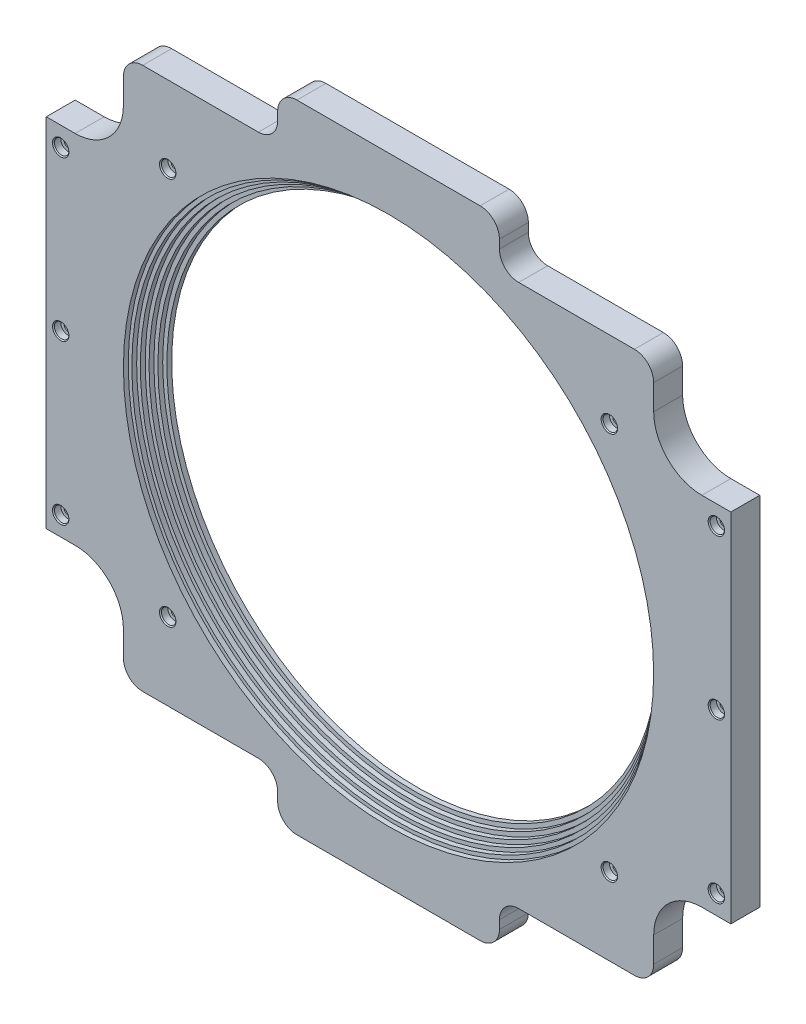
SolidWorks part; units mm, degrees
ref_plane "Front Plane" through (0, 0, 0) normal (0, 0, 1) x (1, 0, 0)
ref_plane "Top Plane" through (0, 0, 0) normal (0, 1, 0) x (1, 0, 0)
ref_plane "Right Plane" through (0, 0, 0) normal (1, 0, 0) x (0, 0, -1)
sketch "Sketch1" plane through (0, 0, 0) normal (0, 0, 1) x (1, 0, 0)
  line L1 (225.425, -209.55) -> (225.425, 209.55)
  line L2 (-225.425, -209.55) -> (-225.425, 209.55)
  line L3 (0, 249.5064) -> (0, -235.6951) construction
  line L4 (225.425, -209.55) -> (-225.425, -209.55)
  line L13 (225.425, 209.55) -> (-225.425, 209.55)
  line L87 (-338.7122, 0) -> (338.7122, 0) construction
  dimension "D2" = 419.1
  dimension "D1" = 450.85
extrude "Extrude1" add sketch "Sketch1" along normal blind 19.05
sketch "Sketch4" plane through (0, 0, 0) normal (0, 1, 0) x (-1, 0, 0)
  line L0 (0, 479.1694) -> (0, -459.1612) construction
  line L2 (-215.9, 146.05) -> (0, 146.05)
  line L3 (0, 146.05) -> (0, -69.85)
  line L8 (-225.425, 0) -> (225.425, 0) construction
  line L9 (-225.425, 19.05) -> (225.425, 19.05) construction
  line L10 (-225.425, 19.05) -> (-225.425, 0) construction
  line L11 (225.425, 19.05) -> (225.425, 0) construction
  arc A3 (-215.9, 146.05) -> (0, -69.85) centre (0, 146.05) ccw
  dimension "D2" = 146.05
  dimension "D1" = 215.9
  dimension "D3" = 127
revolve "Cut-Revolve1" cut sketch "Sketch4" angle 360 about L0
sketch "Sketch13" plane through (0, 0, 0) normal (0, 1, 0) x (1, 0, 0)
  line L0 (0, 117.149) -> (0, -88.8703) construction
  line L1 (-225.425, 0) -> (-174.625, 0)
  line L2 (-225.425, 0) -> (-225.425, 12.7)
  line L3 (-225.425, 12.7) -> (-174.625, 12.7)
  line L4 (-174.625, 0) -> (-174.625, 12.7)
  line L5 (174.625, 0) -> (174.625, 12.7)
  line L6 (225.425, 12.7) -> (174.625, 12.7)
  line L7 (225.425, 0) -> (225.425, 12.7)
  line L8 (225.425, 0) -> (174.625, 0)
  line L9 (225.425, 0) -> (-225.425, 0) construction
  arc A0 (174.5961, -19.05) -> (159.0038, 0) centre (0, -146.05) ccw construction
  dimension "D2" = 158.75
  dimension "D1" = 50.8
extrude "Boss-Extrude1" [suppressed] add sketch "Sketch13" along normal mid plane 254
sketch "Sketch6" plane through (0, 0, 19.05) normal (0, 0, 1) x (1, 0, 0)
  line L0 (-174.625, 209.55) -> (-174.625, 149.225)
  line L1 (40.5951, 0) -> (552.197, 0) construction
  line L2 (225.425, 209.55) -> (-225.425, 209.55) construction
  line L3 (225.425, 209.55) -> (-225.425, 209.55) construction
  line L4 (-206.375, 117.475) -> (-225.425, 117.475)
  line L5 (225.425, 209.55) -> (225.425, 117.475)
  line L6 (0, 261.7294) -> (0, -209.7416) construction
  line L7 (-225.425, -209.55) -> (225.425, -209.55) construction
  line L8 (174.625, -209.55) -> (174.625, -149.225)
  line L9 (-174.625, 209.55) -> (-225.425, 209.55)
  line L10 (-225.425, 209.55) -> (-225.425, 117.475)
  line L11 (206.375, -117.475) -> (225.425, -117.475)
  line L12 (174.625, -209.55) -> (225.425, -209.55)
  line L13 (-225.425, 209.55) -> (-225.425, -209.55) construction
  line L14 (174.625, 209.55) -> (225.425, 209.55)
  line L15 (-225.425, -209.55) -> (-225.425, -117.475)
  line L16 (-174.625, -209.55) -> (-225.425, -209.55)
  line L17 (206.375, 117.475) -> (225.425, 117.475)
  line L18 (174.625, 209.55) -> (174.625, 149.225)
  line L19 (225.425, -209.55) -> (225.425, 209.55) construction
  line L20 (225.425, -209.55) -> (225.425, -117.475)
  line L21 (-206.375, -117.475) -> (-225.425, -117.475)
  line L22 (-174.625, -209.55) -> (-174.625, -149.225)
  line L25 (-225.425, 209.55) -> (-225.425, -209.55) construction
  arc A0 (-174.625, 149.225) -> (-206.375, 117.475) centre (-206.375, 149.225) cw
  arc A1 (174.625, -149.225) -> (206.375, -117.475) centre (206.375, -149.225) cw
  arc A2 (-174.625, -149.225) -> (-206.375, -117.475) centre (-206.375, -149.225) ccw
  arc A3 (174.625, 149.225) -> (206.375, 117.475) centre (206.375, 149.225) ccw
  dimension "D1" = 31.75
  dimension "D2" = 50.8
  dimension "D3" = 117.475
extrude "Cut-Extrude2" cut sketch "Sketch6" against normal through all
hole_wizard "CSK for #10 Flat Head Machine Screw1" positions "Sketch3" profile "Sketch2" counterbore size "#10" standard "ANSI Inch"
sketch "Sketch3" plane through (-1041.591, 12.6399, 19.05) normal (0, 0, 1) x (1, 0, 0)
  line L8 (1013.3222, -12.6399) -> (1626.7288, -12.6399) construction
  line L9 (1041.591, 292.7275) -> (1041.591, -277.4126) construction
  line L15 (816.166, 104.8351) -> (816.166, -130.1149) construction
  line L16 (1267.016, -130.1149) -> (1267.016, 104.8351) construction
  line L17 (1216.216, 196.9101) -> (866.966, 196.9101) construction
  line L18 (866.966, -222.1899) -> (1216.216, -222.1899) construction
  point P56 (825.691, -117.4149)
  point P58 (825.691, 92.1351)
  point P71 (1257.491, 92.1351)
  point P72 (1257.491, -117.4149)
  point P73 (825.691, -12.6399)
  point P75 (1257.491, -12.6399)
  dimension "D1" = 104.775
  dimension "D2" = 9.525
  dimension "D3" = 209.55
  dimension "D4" = 209.55
  dimension "D5" = 104.775
sketch "Sketch2" plane through (-215.9, -104.775, 19.05) normal (1, 0, 0) x (0, -1, 0)
  line L0 (0, 0) -> (0, 19.05)
  line L1 (0, 19.05) -> (2.5527, 19.05)
  line L3 (2.5527, 19.05) -> (2.5527, 4.826)
  line L4 (4.7625, 4.826) -> (2.5527, 4.826)
  line L5 (4.7625, 4.826) -> (4.7625, 0.635)
  line L6 (4.7625, 0.635) -> (5.3975, 0)
  line L7 (5.3975, 0) -> (0, 0)
  line L8 (-4.7625, 0.635) -> (-5.3975, 0) construction
  line L11 (0, -6.35) -> (0, 107.95) construction
  dimension "Thru Hole Dia." = 5.1054
  dimension "Thru Hole Depth" = 19.05
  dimension "C'Bore Dia." = 9.525
  dimension "C'Bore Depth" = 4.826
  dimension "Near C'Sink Dia." = 10.795
  dimension "Near C'Sink Angle" = 90
ref_plane "Plane1" through (-206.375, 0, 0) normal (-1, 0, 0) x (0, 0, 1)
ref_plane "Plane2" through (206.375, 0, 0) normal (1, 0, 0) x (0, 0, -1)
sketch "Sketch9" [suppressed] plane through (0, 0, 19.05) normal (0, 0, 1) x (1, 0, 0)
  line L0 (-92.5491, 187.325) -> (-117.9491, 164.2896)
  line L1 (114.1476, 187.325) -> (-114.1476, 187.325) construction
  line L2 (-92.5491, 187.325) -> (-117.9491, 187.325)
  line L3 (-117.9491, 187.325) -> (-117.9491, 164.2896)
  line L4 (37.6647, 0) -> (541.2136, 0) construction
  line L5 (0, 239.5347) -> (0, -224.9036) construction
  line L6 (117.9491, 187.325) -> (117.9491, 164.2896)
  line L7 (92.5491, 187.325) -> (117.9491, 187.325)
  line L8 (92.5491, 187.325) -> (117.9491, 164.2896)
  arc A0 (-145.8976, 117.475) -> (-114.1476, 149.225) centre (-145.8976, 149.225) ccw construction
  circle A1 centre (0, 0) radius 146.3258 construction
  point P15 (0, 0)
  dimension "D1" = 25.4
extrude "Cut-Extrude3" [suppressed] cut sketch "Sketch9" against normal through all
fillet "Fillet1" [suppressed] radius 12.7
hole_wizard "CSK for #10 Flat Head Machine Screw3" positions "Sketch11" profile "Sketch10" countersink size "#10" standard "Ansi Inch"
sketch "Sketch11" plane through (0, 0, 5023.9787) normal (0, 0, 1) x (1, 0, 0)
  line L0 (28.4264, 0) -> (600.4187, 0) construction
  line L2 (298.9946, 243.5395) -> (298.9946, -263.2817) construction
  line L4 (73.5696, 117.475) -> (73.5696, -117.475) construction
  line L5 (524.4196, -117.475) -> (524.4196, 117.475) construction
  ellipse E0 centre (506.3852, 123.825) end of major axis (511.8382, 123.825) minor radius 4.7625 construction
  point P0 (500.9321, 123.825)
  point P10 (467.2696, 123.825)
  point P26 (130.7196, 123.825)
  point P27 (97.057, 123.825)
  point P28 (97.057, -123.825)
  point P29 (130.7196, -123.825)
  point P30 (467.2696, -123.825)
  point P31 (500.9321, -123.825)
sketch "Sketch10" plane through (500.9321, 123.825, 5023.9787) normal (1, 0, 0) x (0, -1, 0)
  line L0 (0, 0) -> (0, 19.05)
  line L1 (0, 19.05) -> (2.5527, 19.05)
  line L2 (2.5527, 19.05) -> (2.5527, 2.9422)
  line L3 (2.5527, 2.9422) -> (5.1103, 0)
  line L5 (5.1103, 0) -> (0, 0)
  line L6 (-2.5527, 2.9422) -> (-5.1103, 0) construction
  line L11 (0, -6.35) -> (0, 107.95) construction
  dimension "Thru Hole Dia." = 5.1054
  dimension "Thru Hole Depth" = 19.05
  dimension "Near C'Sink Dia." = 10.2206
  dimension "Near C'Sink Angle" = 82
sketch "Sketch12" [suppressed] plane through (0, 0, 19.05) normal (0, 0, 1) x (1, 0, 0)
  line L0 (-225.425, 117.475) -> (-145.8976, 117.475) construction
  line L1 (68.3138, 235.9936) -> (538.7035, 235.9936)
  line L2 (68.3138, 235.9936) -> (68.3138, 117.475)
  line L3 (68.3138, 117.475) -> (538.7035, 117.475)
  line L4 (538.7035, 235.9936) -> (538.7035, 117.475)
  line L5 (538.7035, -235.9936) -> (538.7035, -117.475)
  line L6 (0, 0) -> (609.9375, 0) construction
  line L7 (68.3138, -117.475) -> (538.7035, -117.475)
  line L8 (68.3138, -235.9936) -> (68.3138, -117.475)
  line L9 (68.3138, -235.9936) -> (538.7035, -235.9936)
extrude "Cut-Extrude4" [suppressed] cut sketch "Sketch12" against normal up to next
sketch "Sketch18" plane through (0, 0, 19.05) normal (0, 0, 1) x (1, 0, 0)
  line L0 (-161.925, 178.562) -> (161.925, 178.562) construction
  line L1 (-161.925, 178.562) -> (-85.725, 178.562)
  line L2 (-73.025, 191.262) -> (-73.025, 209.55)
  line L3 (174.625, 209.55) -> (-174.625, 209.55) construction
  line L4 (-73.025, 209.55) -> (-174.625, 209.55)
  line L5 (-174.625, 209.55) -> (-174.625, 165.862)
  line L6 (0, 0) -> (0, 341.8315) construction
  line L7 (-285.496, 0) -> (312.9281, 0) construction
  line L8 (174.625, 209.55) -> (174.625, 165.862)
  line L9 (73.025, 209.55) -> (174.625, 209.55)
  line L10 (73.025, 191.262) -> (73.025, 209.55)
  line L11 (161.925, 178.562) -> (85.725, 178.562)
  line L12 (161.925, -178.562) -> (85.725, -178.562)
  line L13 (73.025, -191.262) -> (73.025, -209.55)
  line L14 (73.025, -209.55) -> (174.625, -209.55)
  line L15 (174.625, -209.55) -> (174.625, -165.862)
  line L16 (-174.625, -209.55) -> (-174.625, -165.862)
  line L17 (-73.025, -209.55) -> (-174.625, -209.55)
  line L18 (-73.025, -191.262) -> (-73.025, -209.55)
  line L19 (-161.925, -178.562) -> (-85.725, -178.562)
  arc A0 (-161.925, 178.562) -> (-174.625, 165.862) centre (-161.925, 165.862) ccw construction
  arc A1 (-161.925, 178.562) -> (-174.625, 165.862) centre (-161.925, 165.862) ccw
  arc A2 (-73.025, 191.262) -> (-85.725, 178.562) centre (-85.725, 191.262) cw
  arc A3 (73.025, 191.262) -> (85.725, 178.562) centre (85.725, 191.262) ccw
  arc A4 (161.925, 178.562) -> (174.625, 165.862) centre (161.925, 165.862) cw
  arc A5 (161.925, -178.562) -> (174.625, -165.862) centre (161.925, -165.862) ccw
  arc A6 (73.025, -191.262) -> (85.725, -178.562) centre (85.725, -191.262) cw
  arc A7 (-73.025, -191.262) -> (-85.725, -178.562) centre (-85.725, -191.262) ccw
  arc A8 (-161.925, -178.562) -> (-174.625, -165.862) centre (-161.925, -165.862) cw
  dimension "D2" = 12.7
  dimension "D1" = 101.6
extrude "Cut-Extrude6" cut sketch "Sketch18" against normal through all
hole_wizard "CBORE for #10 Socket Head Cap Screw1" positions "Sketch15" profile "Sketch14" counterbore size "#10" standard "ANSI Inch"
sketch "Sketch15" plane through (0, 0, 19.05) normal (0, 0, 1) x (1, 0, 0)
  line L4 (-248.1702, -127.762) -> (254.3296, -127.762) construction
  line L6 (-74.516, -140.462) -> (74.516, -140.462) construction
  line L7 (109.7403, -115.062) -> (-109.7403, -115.062) construction
  line L8 (-174.625, -165.862) -> (-174.625, -149.225) construction
  line L9 (174.625, -149.225) -> (174.625, -165.862) construction
  line L10 (-290.8812, 0) -> (327.202, 0) construction
  line L11 (0, 298.3796) -> (0, -74.091) construction
  point P12 (-145.415, -127.762)
  point P14 (145.415, -127.762)
  point P25 (145.415, 127.762)
  point P26 (-145.415, 127.762)
  point P52 (0, 0)
  point P53 (0, 0)
  point P54 (0, 0)
  point P55 (0, 0)
  point P56 (0, 0)
  point P57 (0, 0)
  point P58 (0, 0)
  point P59 (0, 0)
  dimension "D1" = 29.21
  dimension "D2" = 29.21
sketch "Sketch14" plane through (-145.415, 127.762, 19.05) normal (1, 0, 0) x (0, -1, 0)
  line L0 (0, 0) -> (0, 19.05)
  line L1 (0, 19.05) -> (2.5527, 19.05)
  line L3 (2.5527, 19.05) -> (2.5527, 4.826)
  line L4 (4.7625, 4.826) -> (2.5527, 4.826)
  line L5 (4.7625, 4.826) -> (4.7625, 0.635)
  line L6 (4.7625, 0.635) -> (5.3975, 0)
  line L7 (5.3975, 0) -> (0, 0)
  line L8 (-4.7625, 0.635) -> (-5.3975, 0) construction
  line L11 (0, -6.35) -> (0, 107.95) construction
  dimension "Thru Hole Dia." = 5.1054
  dimension "Thru Hole Depth" = 19.05
  dimension "C'Bore Dia." = 9.525
  dimension "C'Bore Depth" = 4.826
  dimension "Near C'Sink Dia." = 10.795
  dimension "Near C'Sink Angle" = 90
fillet "Fillet3" radius 12.7 4 edges at (-73.025, -209.55, 9.525) (73.025, -209.55, 9.525) (-73.025, 209.55, 9.525) (73.025, 209.55, 9.525)
sketch "Sketch19" plane through (0, 0, 0) normal (1, 0, 0) x (0, 0, -1)
  line L0 (-19.05, -174.5961) -> (-15.875, -174.5961)
  line L1 (-15.875, -174.5961) -> (-15.875, -172.2419)
  line L2 (-15.875, -172.2419) -> (-12.7, -172.2419)
  line L3 (-12.7, -172.2419) -> (-12.7, -169.7957)
  line L4 (-12.7, -169.7957) -> (-9.525, -169.7957)
  line L5 (-9.525, -169.7957) -> (-9.525, -167.2535)
  line L6 (-9.525, -167.2535) -> (-6.35, -167.2535)
  line L7 (-6.35, -167.2535) -> (-6.35, -164.6108)
  line L9 (-6.35, -164.6108) -> (-3.175, -164.6108)
  line L10 (-3.175, -164.6108) -> (-3.175, -161.8627)
  line L12 (0, -161.8627) -> (0, -159.0038)
  line L13 (-3.175, -161.8627) -> (0, -161.8627)
  line L14 (-168.9293, 0) -> (104.8716, 0) construction
  line L17 (0, -159.0038) -> (-19.05, -159.0038)
  line L19 (-19.05, -159.0038) -> (-19.05, -174.5961)
  arc A0 (-19.05, -174.5961) -> (0, -159.0038) centre (-146.05, 0) ccw construction
  dimension "D1" = 3.175
revolve "Cut-Revolve2" cut sketch "Sketch19" angle 360 about L14
sketch "Sketch20" [suppressed] plane through (0, 0, 19.05) normal (0, 0, 1) x (1, 0, 0)
  line L0 (-225.425, 117.475) -> (-225.425, -117.475) construction
  line L1 (-225.425, 82.55) -> (-327.025, 82.55)
  line L2 (-225.425, 82.55) -> (-225.425, -117.475)
  line L3 (-225.425, -117.475) -> (-327.025, -117.475)
  line L4 (-327.025, 82.55) -> (-327.025, -117.475)
  line L5 (-225.425, 117.475) -> (-206.375, 117.475) construction
  line L6 (-206.375, -117.475) -> (-225.425, -117.475) construction
  dimension "D1" = 34.925
  dimension "D2" = 0
  dimension "D3" = 101.6
extrude "Boss-Extrude2" [suppressed] add sketch "Sketch20" against normal blind 19.05
sketch "Sketch21" [suppressed] plane through (0, 0, 19.05) normal (0, 0, 1) x (1, 0, 0)
  circle A0 centre (-257.605, 0) radius 60.325
extrude "Cut-Extrude7" [suppressed] cut sketch "Sketch21" against normal through all
sketch "Sketch22" [suppressed] plane through (0, 0, 19.05) normal (0, 0, 1) x (1, 0, 0)
  line L0 (-257.605, 0) -> (-257.605, -110.49)
  line L1 (-257.605, -110.49) -> (-244.905, -110.49)
  line L2 (-244.905, -110.49) -> (-244.905, 0)
  line L3 (-244.905, 0) -> (-257.605, 0)
  line L4 (-257.605, 0) -> (-270.305, 0)
  line L5 (-270.305, 0) -> (-270.305, -110.49)
  line L6 (-270.305, -110.49) -> (-257.605, -110.49)
extrude "Cut-Extrude8" [suppressed] cut sketch "Sketch22" against normal through all contours L5 L6 L0 L4 | L2 L3 L0 L1
sketch "Sketch23" [suppressed] plane through (0, 0, 19.05) normal (0, 0, 1) x (1, 0, 0)
  line L1 (-327.025, -117.475) -> (-161.925, -117.475)
  line L2 (-327.025, -117.475) -> (-327.025, -178.562)
  line L3 (-327.025, -178.562) -> (-161.925, -178.562)
  line L4 (-161.925, -117.475) -> (-161.925, -178.562)
extrude "Boss-Extrude3" [suppressed] add sketch "Sketch23" against normal blind 19.05 contours L2 L3 L4 L1
sketch "Sketch24" [suppressed] plane through (0, 0, 19.05) normal (0, 0, 1) x (1, 0, 0)
  line L1 (-270.305, -110.49) -> (-244.905, -110.49) construction
  circle A0 centre (-277.036, -135.89) radius 2.286
  circle A1 centre (-238.174, -135.89) radius 2.286
  point P6 (-257.605, -110.49)
  dimension "D1" = 4.572
  dimension "D2" = 4.572
  dimension "D3" = 25.4
  dimension "D4" = 25.4
  dimension "D5" = 38.862
  dimension "D6" = 19.431
extrude "Cut-Extrude10" [suppressed] cut sketch "Sketch24" against normal blind 19.05
sketch "Sketch25" [suppressed] plane through (0, 0, 19.05) normal (0, 0, 1) x (1, 0, 0)
  line L0 (-327.025, 82.55) -> (-327.025, -178.562) construction
  line L1 (-327.025, -82.55) -> (-298.45, -82.55)
  line L2 (-327.025, -82.55) -> (-327.025, -178.562)
  line L3 (-327.025, -178.562) -> (-298.45, -178.562)
  line L4 (-298.45, -82.55) -> (-298.45, -178.562)
  line L5 (-85.725, -178.562) -> (-327.025, -178.562) construction
  line L6 (-225.425, 82.55) -> (-327.025, 82.55) construction
  dimension "D1" = 28.575
  dimension "D2" = 165.1
extrude "Cut-Extrude11" [suppressed] cut sketch "Sketch25" against normal blind 19.05
fillet "Fillet4" [suppressed] radius 12.7
